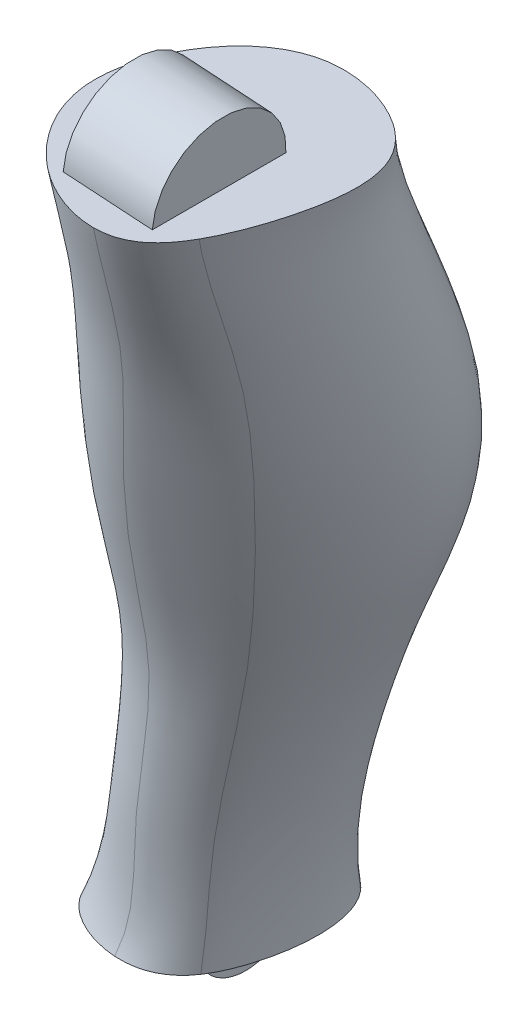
SolidWorks part; units mm, degrees
ref_plane "Front Plane" through (0, 0, 0) normal (0, 0, 1) x (1, 0, 0)
ref_plane "Top Plane" through (0, 0, 0) normal (0, 1, 0) x (1, 0, 0)
ref_plane "Right Plane" through (0, 0, 0) normal (1, 0, 0) x (0, 0, -1)
imported_body "Stock-Source-1"
ref_plane "Plane1" through (0, 0, 88.9) normal (0, 0, 1) x (1, 0, 0)
sketch "Sketch1" plane through (0, 0, 88.9) normal (0, 0, 1) x (1, 0, 0)
  line L0 (-174.3167, 3251.163) -> (-130.6986, 3248.362)
  line L1 (-174.3167, 3251.163) -> (-172.2209, 3283.8003)
  line L2 (-130.6986, 3248.362) -> (-128.6028, 3280.9994)
  line L3 (-172.2209, 3283.8003) -> (-128.6028, 3280.9994)
  line L4 (-145.1388, 3249.2893) -> (-203.4946, 3253.0366) construction
  line L5 (-116.2585, 3247.4348) -> (-145.1388, 3249.2893) construction
  dimension "D1" = 32.7046
revolve "Revolve1" add sketch "Sketch1" angle 360 about L0
sketch "Sketch2" plane through (0, 0, 0) normal (0, 0, 1) x (1, 0, 0)
  line L0 (-236.6748, 2862.7757) -> (-205.0479, 2860.8765)
  line L1 (-236.6748, 2862.7757) -> (-238.1974, 2837.4214)
  line L2 (-205.0479, 2860.8765) -> (-206.5704, 2835.5221)
  line L3 (-238.1974, 2837.4214) -> (-206.5704, 2835.5221)
  line L4 (-254.755, 2863.8615) -> (-218.5946, 2861.69) construction
  line L5 (-218.5946, 2861.69) -> (-191.5011, 2860.0629) construction
  dimension "D1" = 25.4
revolve "Revolve2" add sketch "Sketch2" angle 360 about L0
